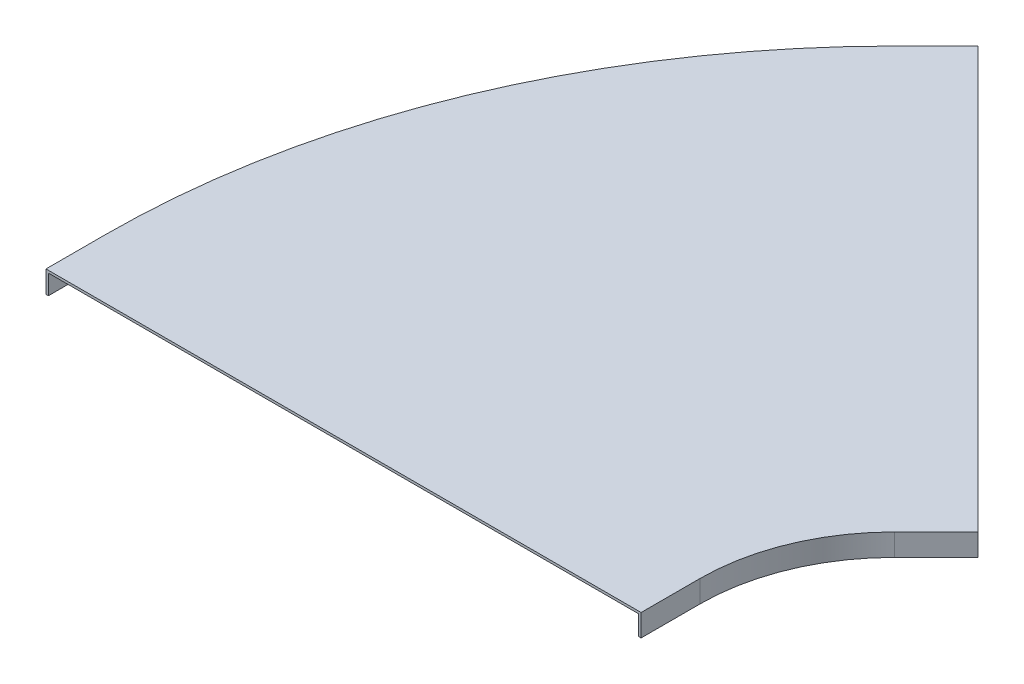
SolidWorks part; units mm, degrees
ref_plane "Front Plane" through (0, 0, 0) normal (0, 0, 1) x (1, 0, 0)
ref_plane "Top Plane" through (0, 0, 0) normal (0, 1, 0) x (1, 0, 0)
ref_plane "Right Plane" through (0, 0, 0) normal (1, 0, 0) x (0, 0, -1)
sketch "Sketch2" plane through (0, 0, 0) normal (0, 1, 0) x (1, 0, 0)
  line L0 (0, 0) -> (-100, 0) construction
  line L1 (-100, 0) -> (-100, 30) construction
  line L2 (0, 0) -> (0, 30)
  line L3 (29.2893, 100.7107) -> (50.5025, 121.9239)
  line L4 (50.5025, 121.9239) -> (-20.2082, 192.6346) construction
  line L5 (-20.2082, 192.6346) -> (-41.4214, 171.4214) construction
  arc A0 (0, 30) -> (29.2893, 100.7107) centre (100, 30) cw
  arc A1 (-41.4214, 171.4214) -> (-100, 30) centre (100, 30) ccw construction
  dimension "D4" = 100
  dimension "D1" = 30
  dimension "D2" = 45
  dimension "D3" = 100
sketch "Sketch3" plane through (0, 0, 0) normal (0, 0, 1) x (1, 0, 0)
  line L0 (0, -10) -> (0, 0)
  line L1 (0, 0) -> (-300, 0)
  line L2 (-300, 0) -> (-300, -10)
  line L3 (1.214, -10) -> (1.214, 1.214)
  line L4 (1.214, 1.214) -> (-301.214, 1.214)
  line L5 (-301.214, 1.214) -> (-301.214, -10)
  line L7 (-301.214, 1.214) -> (-301.214, -10.7848) construction
  line L10 (-300, -10) -> (-301.214, -10)
  line L11 (0, -10) -> (1.214, -10)
  line L12 (1.214, -11.4139) -> (1.214, 1.214) construction
  arc A4 (0, -10) -> (1.6033, -19.736) centre (0, -15) ccw construction
  arc A5 (-300, -10) -> (-304.0313, -19.1069) centre (-302.428, -14.3709) cw construction
  arc A6 (1.214, -11.4139) -> (1.214, -18.5861) centre (0, -15) ccw construction
  arc A7 (-301.214, -10.7848) -> (-303.642, -17.957) centre (-302.428, -14.3709) cw construction
  dimension "D1" = 300
  dimension "D2" = 10
  dimension "D4" = 1.214
sweep "Sweep1" add profiles "Sketch3" path "Sketch2"
